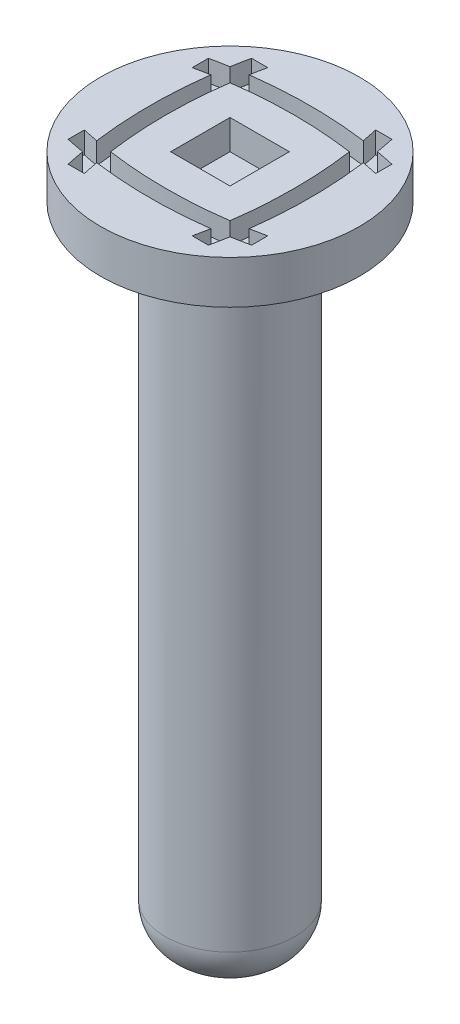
SolidWorks part; units mm, degrees
ref_plane "Front Plane" through (0, 0, 0) normal (0, 0, 1) x (1, 0, 0)
ref_plane "Top Plane" through (0, 0, 0) normal (0, 1, 0) x (1, 0, 0)
ref_plane "Right Plane" through (0, 0, 0) normal (1, 0, 0) x (0, 0, -1)
sketch "Sketch1" plane through (0, 0, 0) normal (0, 1, 0) x (1, 0, 0)
  circle A0 centre (0, 0) radius 24
  dimension "D1" = 48
extrude "Boss-Extrude1" add sketch "Sketch1" along normal blind 8
sketch "Sketch3" plane through (0, 8, 0) normal (0, 1, 0) x (1, 0, 0)
  line L0 (-5.5, 5.5) -> (5.5, 5.5)
  line L1 (5.5, 5.5) -> (5.5, -5.5)
  line L2 (5.5, -5.5) -> (-5.5, -5.5)
  line L3 (-5.5, -5.5) -> (-5.5, 5.5)
  dimension "D1" = 11
  dimension "D2" = 5.5
  dimension "D3" = 11
  dimension "D4" = 5.5
extrude "Cut-Extrude2" cut sketch "Sketch3" against normal blind 5.5
sketch "Sketch10" plane through (0, 8, 0) normal (0, 1, 0) x (1, 0, 0)
  line L1 (-17, 13) -> (-17, 10)
  line L3 (17, 10) -> (17, 13)
  line L4 (10, -17) -> (13, -17)
  line L5 (13, 17) -> (10, 17)
  line L7 (-17, -10) -> (-17, -13)
  line L8 (17, -13) -> (17, -10)
  line L10 (-10, 17) -> (-13, 17)
  line L11 (-13, -17) -> (-10, -17)
  arc A0 (-17, 13) -> (-13.6534, 13.6534) centre (0, -65.1729) cw
  arc A1 (-17, 10) -> (-14.125, 10.5759) centre (0, -67.4053) cw
  arc A2 (10, 17) -> (10.5759, 14.125) centre (-67.4053, 0) cw
  arc A3 (13, 17) -> (13.6534, 13.6534) centre (-65.1729, 0) cw
  arc A4 (17, -10) -> (14.125, -10.5759) centre (0, 67.4053) cw
  arc A5 (17, -13) -> (13.6534, -13.6534) centre (0, 65.1729) cw
  arc A6 (-10, -17) -> (-10.5759, -14.125) centre (67.4053, 0) cw
  arc A7 (-13, -17) -> (-13.6534, -13.6534) centre (65.1729, 0) cw
  arc A8 (-10.5759, 14.125) -> (-10, 17) centre (67.4053, 0) cw
  arc A9 (-13.6534, 13.6534) -> (-13, 17) centre (65.1729, 0) cw
  arc A10 (-11.0681, 11.0681) -> (11.0681, 11.0681) centre (0, -67.4053) cw
  arc A11 (-10.5759, 14.125) -> (10.5759, 14.125) centre (0, -65.1729) cw
  arc A12 (13.6534, 13.6534) -> (17, 13) centre (0, -65.1729) cw
  arc A13 (14.125, 10.5759) -> (17, 10) centre (0, -67.4053) cw
  arc A14 (11.0681, 11.0681) -> (11.0681, -11.0681) centre (-67.4053, 0) cw
  arc A15 (14.125, 10.5759) -> (14.125, -10.5759) centre (-65.1729, 0) cw
  arc A16 (13.6534, -13.6534) -> (13, -17) centre (-65.1729, 0) cw
  arc A17 (10.5759, -14.125) -> (10, -17) centre (-67.4053, 0) cw
  arc A18 (11.0681, -11.0681) -> (-11.0681, -11.0681) centre (0, 67.4053) cw
  arc A19 (10.5759, -14.125) -> (-10.5759, -14.125) centre (0, 65.1729) cw
  arc A20 (-13.6534, -13.6534) -> (-17, -13) centre (0, 65.1729) cw
  arc A21 (-14.125, -10.5759) -> (-14.125, 10.5759) centre (65.1729, 0) cw
  arc A22 (-14.125, -10.5759) -> (-17, -10) centre (0, 67.4053) cw
  arc A23 (-11.0681, -11.0681) -> (-11.0681, 11.0681) centre (67.4053, 0) cw
  point P36 (0, 0)
extrude "Cut-Extrude6" cut sketch "Sketch10" against normal blind 4
sketch "Sketch11" plane through (0, 0, 0) normal (0, 0, 1) x (1, 0, 0)
  line L0 (0, 0) -> (0, -120)
  line L1 (0, -120) -> (12, -120)
  line L2 (12, -120) -> (12, 0)
  line L3 (-24, 0) -> (24, 0) construction
  line L4 (12, 0) -> (0, 0)
  dimension "D1" = 12
  dimension "D2" = 120
revolve "Revolve1" add sketch "Sketch11" angle 360 about L0
fillet "Fillet1" radius 8 1 edges at (-12, -120, 0)
equation "\"D2@Sketch10\"=\"D1@Sketch10\"/2"
